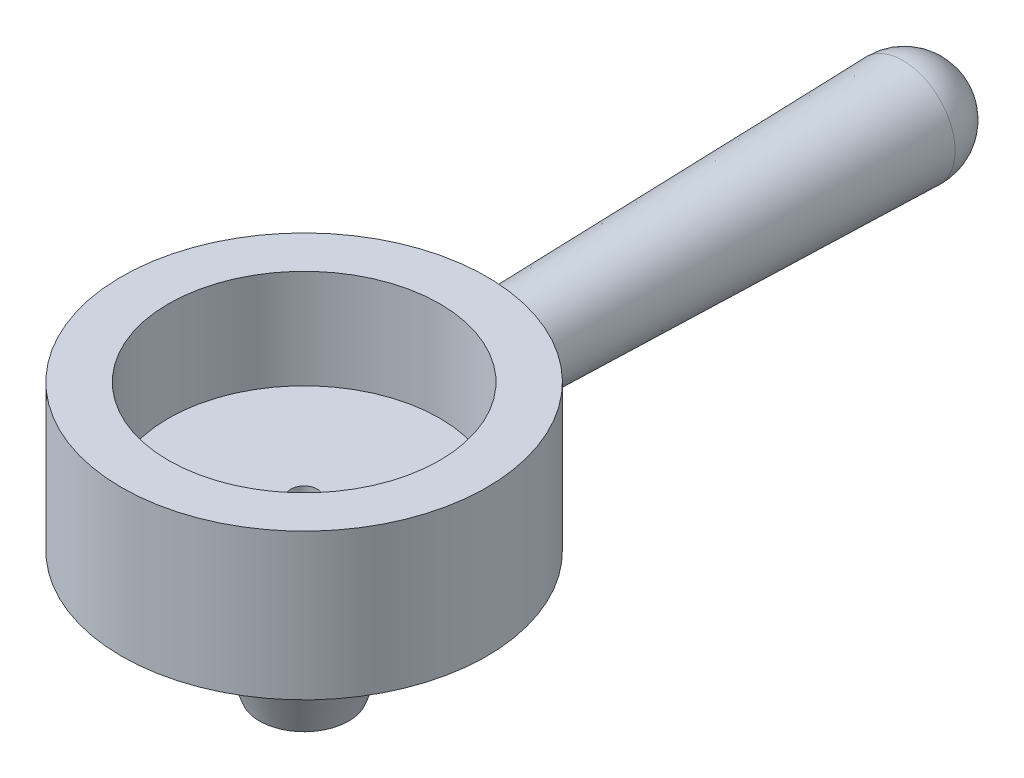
SolidWorks part; units mm, degrees
ref_plane "Front Plane" through (0, 0, 0) normal (0, 0, 1) x (1, 0, 0)
ref_plane "Top Plane" through (0, 0, 0) normal (0, 1, 0) x (1, 0, 0)
ref_plane "Right Plane" through (0, 0, 0) normal (1, 0, 0) x (0, 0, -1)
body saved out of another part "Stock-Donut Shop-1"
ref_plane "Plane1" through (144, 0, 0) normal (1, 0, 0) x (0, 0, -1)
